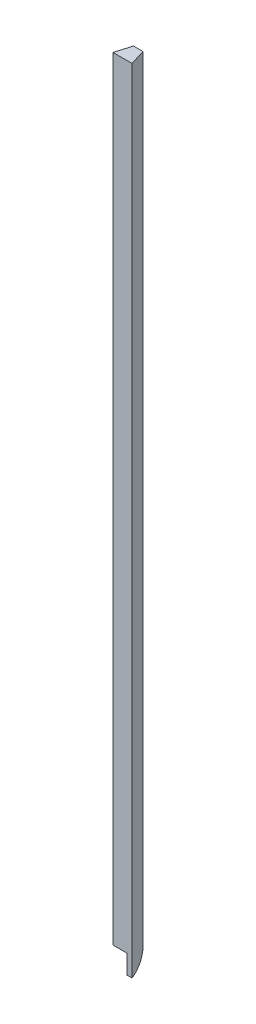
SolidWorks part; units mm, degrees
ref_plane "Front Plane" through (0, 0, 0) normal (0, 0, 1) x (1, 0, 0)
ref_plane "Top Plane" through (0, 0, 0) normal (0, 1, 0) x (1, 0, 0)
ref_plane "Right Plane" through (0, 0, 0) normal (1, 0, 0) x (0, 0, -1)
sketch "Sketch1" plane through (0, 0, 0) normal (0, 1, 0) x (1, 0, 0)
  line L0 (-7.62, 0) -> (7.62, 0)
  line L1 (7.62, 0) -> (3.81, 12.7)
  line L2 (3.81, 12.7) -> (-3.81, 12.7)
  line L3 (-3.81, 12.7) -> (-7.62, 0)
  dimension "D1" = 12.7
  dimension "D2" = 15.24
  dimension "D3" = 7.62
  dimension "D4" = 3.81
  dimension "D5" = 7.62
extrude "Boss-Extrude1" add sketch "Sketch1" along normal blind 635
sketch "Sketch3" plane through (0, 0, 0) normal (0, -1, 0) x (-1, 0, 0)
  line L1 (7.62, 0) -> (3.81, 12.7)
  line L2 (3.81, 12.7) -> (-3.81, 12.7)
  line L3 (-3.81, 12.7) -> (3.81, 12.7) construction
  line L4 (-3.81, 12.7) -> (-3.81, 0)
  line L5 (7.62, 0) -> (-7.62, 0) construction
  line L6 (-3.81, 0) -> (7.62, 0)
  dimension "D1" = 3.81
extrude "Cut-Extrude2" cut sketch "Sketch3" against normal blind 15.24
sketch "Sketch4" plane through (3.81, 0, 0) normal (-1, 0, 0) x (0, 0, 1)
  line L0 (-12.7, 0) -> (0, 0)
  line L4 (-12.7, 12.7) -> (-12.7, 0)
  arc A0 (-12.7, 12.7) -> (0, 0) centre (1.27, 13.97) ccw
extrude "Cut-Extrude3" cut sketch "Sketch4" against normal blind 15.24
